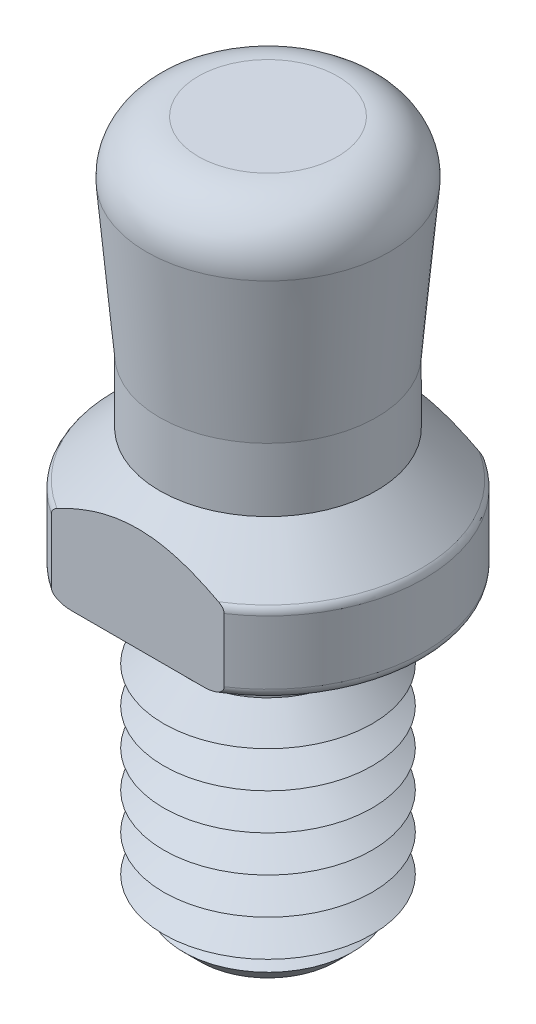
SolidWorks part; units mm, degrees
ref_plane "Front Plane" through (0, 0, 0) normal (0, 0, 1) x (1, 0, 0)
ref_plane "Top Plane" through (0, 0, 0) normal (0, 1, 0) x (1, 0, 0)
ref_plane "Right Plane" through (0, 0, 0) normal (1, 0, 0) x (0, 0, -1)
sketch "Sketch1" plane through (0, 0, 0) normal (1, 0, 0) x (0, 0, -1)
  line L0 (0, 69.5403) -> (0, -60.8671) construction
sketch "Sketch2" plane through (0, 0, 0) normal (1, 0, 0) x (0, 0, -1)
  line L0 (0, 0) -> (-2.8, 0)
  line L1 (-3, 0.2) -> (-3, 1.4172)
  line L2 (-2.9414, 1.5586) -> (-2.0808, 2.4192)
  line L3 (-2.0808, 2.4192) -> (-2.0808, 3.6364)
  line L4 (-2.0808, 3.6364) -> (-2.3324, 6.5128)
  line L5 (-1.3362, 7.6) -> (0, 7.6)
  line L6 (0, 69.5403) -> (0, -60.8671) construction
  line L7 (0, 7.6) -> (0, 0)
  arc A0 (-2.3324, 6.5128) -> (-1.3362, 7.6) centre (-1.3362, 6.6) cw
  arc A1 (-3, 1.4172) -> (-2.9414, 1.5586) centre (-2.8, 1.4172) cw
  arc A2 (-2.8, 0) -> (-3, 0.2) centre (-2.8, 0.2) cw
  point P14 (-3, 1.5)
  point P17 (-3, 0)
  dimension "D6" = 1
  dimension "D7" = 0.2
  dimension "D1" = 3
  dimension "D2" = 7.6
  dimension "D3" = 45
  dimension "D4" = 5
  dimension "D5" = 1.5
revolve "Revolve1" add sketch "Sketch2" angle 360 about L0
sketch "Sketch4" plane through (0, 0, 0) normal (0, 1, 0) x (1, 0, 0)
  line L0 (-2.0974, -2.5) -> (2.0974, -2.5)
  line L2 (2.0974, 2.5) -> (-2.0974, 2.5)
  arc A0 (-2.0974, -2.5) -> (2.0974, -2.5) centre (0, 0) ccw
  arc A1 (2.0974, 2.5) -> (-2.0974, 2.5) centre (0, 0) ccw
  dimension "D1" = 5
extrude "Cut-Extrude1" cut sketch "Sketch4" along normal blind 2
sketch "Sketch5" plane through (0, 0, 0) normal (1, 0, 0) x (0, 0, -1)
  line L0 (0, 0) -> (-1.505, 0)
  line L1 (-2.5, 0) -> (2.5, 0) construction
  line L2 (-1.505, 0) -> (-1.505, -1)
  line L3 (-1.505, -1) -> (-2, -1.495)
  line L4 (-2, -1.495) -> (-2, -5.8)
  line L5 (-2, -5.8) -> (0, -5.8)
  line L6 (0, 69.5403) -> (0, -60.8671) construction
  line L7 (0, -5.8) -> (0, 0)
  dimension "D1" = 2
  dimension "D2" = 5.8
  dimension "D3" = 1
  dimension "D4" = 45
  dimension "D5" = 0.7
revolve "Revolve3" add sketch "Sketch5" angle 360 about L0
chamfer "Chamfer2" distance 0.7 angle 45 1 edges at (0, -5.8, 2)
sketch "Sketch6" plane through (0, 0, 0) normal (1, 0, 0) x (0, 0, -1)
  line L0 (-2, -1.495) -> (-1.3938, -1.845)
  line L1 (-1.3938, -1.845) -> (-2, -2.195)
  line L2 (-2, -1.495) -> (-2, -5.1) construction
  line L3 (-2, -2.195) -> (-2, -1.495)
  dimension "D1" = 0.7
revolve "Cut-Revolve1" cut sketch "Sketch6" angle 360 about L0
pattern_linear "LPattern1" count 6 spacing 0.7 along (0, -1, 0) of "Cut-Revolve1"
